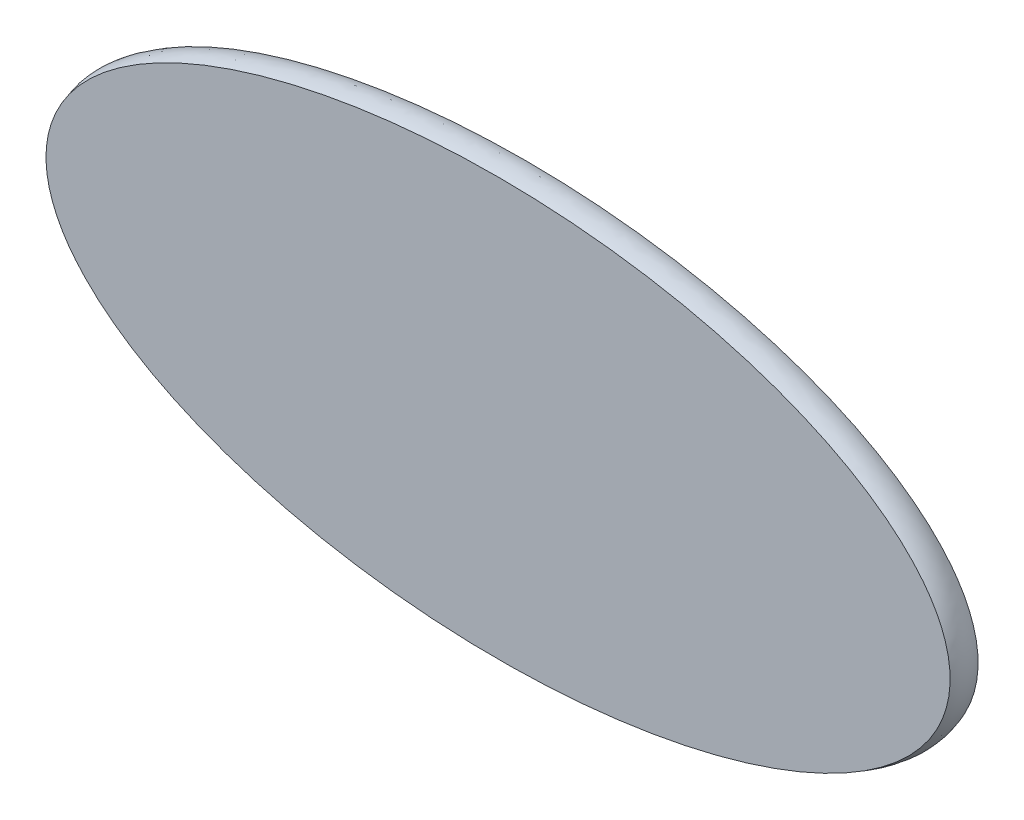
SolidWorks part; units mm, degrees
ref_plane "Ebene vorne" through (0, 0, 0) normal (0, 0, 1) x (1, 0, 0)
ref_plane "Ebene oben" through (0, 0, 0) normal (0, 1, 0) x (1, 0, 0)
ref_plane "Ebene rechts" through (0, 0, 0) normal (1, 0, 0) x (0, 0, -1)
sketch "Skizze1" plane through (0, 0, 0) normal (0, 0, 1) x (1, 0, 0)
  line L0 (-80.7958, 0) -> (80.7958, 0) construction
  line L1 (0, 37.3203) -> (0, -37.3203) construction
  ellipse E0 centre (0, 0) end of major axis (-80.7958, 0) minor radius 37.3203
ref_plane "Ebene1" through (0, 0, 5) normal (0, 0, 1) x (1, 0, 0)
sketch "Skizze2" plane through (0, 0, 5) normal (0, 0, 1) x (1, 0, 0)
  ellipse E0 centre (0, 0) end of major axis (-80.7958, 0) minor radius 37.3203 construction
  ellipse E1 centre (0, 0) end of major axis (-80.7958, 0) minor radius 37.3203
sketch "Skizze3" plane through (0, 0, 0) normal (1, 0, 0) x (0, 0, -1)
  line L2 (-5, 37.3203) -> (0, 37.3203) construction
  line L3 (0, 37.3203) -> (0, -37.3203) construction
  line L6 (-2.5, 37.3203) -> (-2.5, 31.4323) construction
  arc A0 (2.2537, 35.7126) -> (-7.4228, 35.5169) centre (-2.5, 31.4323) ccw
extrude "Linear austragen1" add sketch "Skizze2" against normal blind 5
other "Fläche verschieben1"
surface "Oberfläche-Austragung2"
other "Oberflächenschnitt1"
equation "\"LÄNGE\"=0"
equation "\"BREITE\"=0"
equation "\"HÖHE\"=0"
equation "\"DURCHMESSER\"=0"
equation "\"Stückzahl\"= 1"
